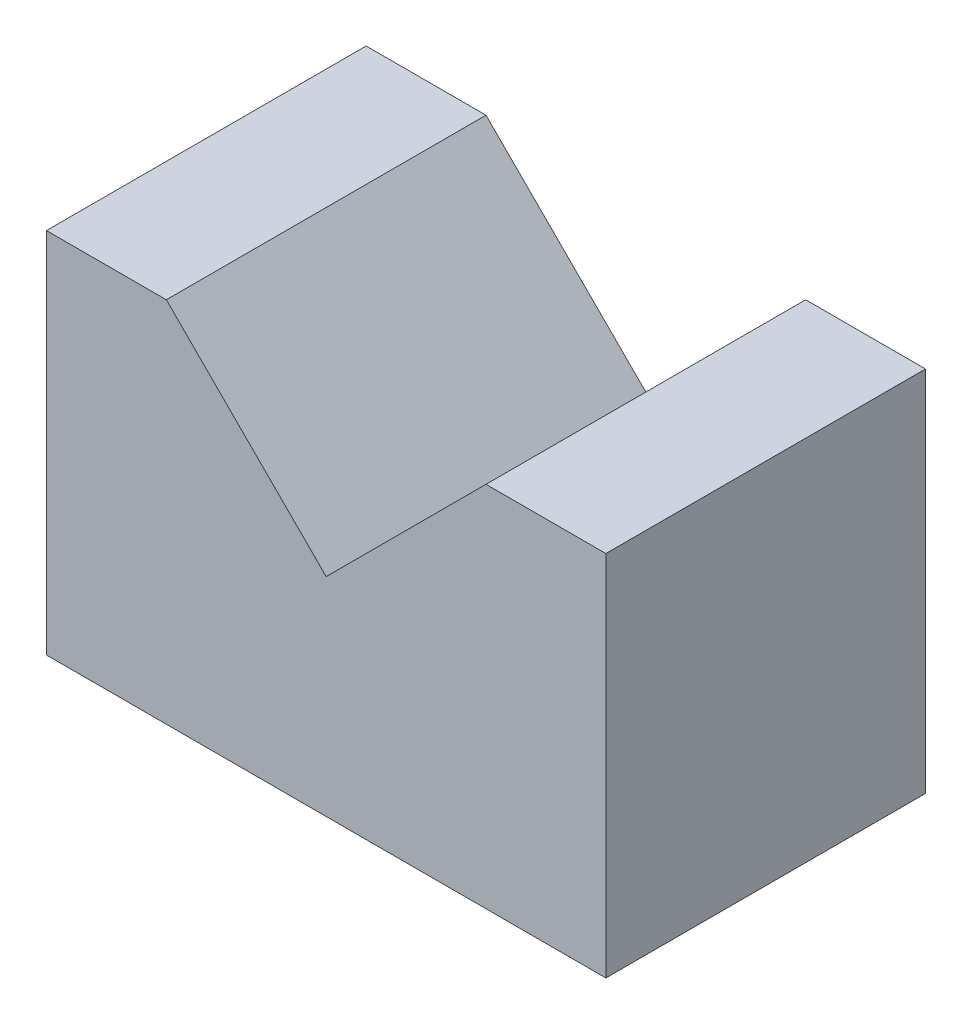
SolidWorks part; units mm, degrees
ref_plane "Plan de face" through (0, 0, 0) normal (0, 0, 1) x (1, 0, 0)
ref_plane "Plan de dessus" through (0, 0, 0) normal (0, 1, 0) x (1, 0, 0)
ref_plane "Plan de droite" through (0, 0, 0) normal (1, 0, 0) x (0, 0, -1)
sketch "Esquisse1" plane through (0, 0, 0) normal (0, 0, 1) x (1, 0, 0)
  line L0 (0, 0) -> (0, 46)
  line L1 (0, 46) -> (15, 46)
  line L2 (15, 46) -> (35, 26)
  line L3 (35, 26) -> (55, 46)
  line L4 (55, 46) -> (70, 46)
  line L5 (70, 46) -> (70, 0)
  line L6 (70, 0) -> (0, 0)
  dimension "D1" = 70
  dimension "D2" = 46
  dimension "D3" = 90
  dimension "D4" = 46
  dimension "D5" = 15
  dimension "D6" = 15
  dimension "D7" = 26
extrude "Extrusion1" add sketch "Esquisse1" along normal blind 40
